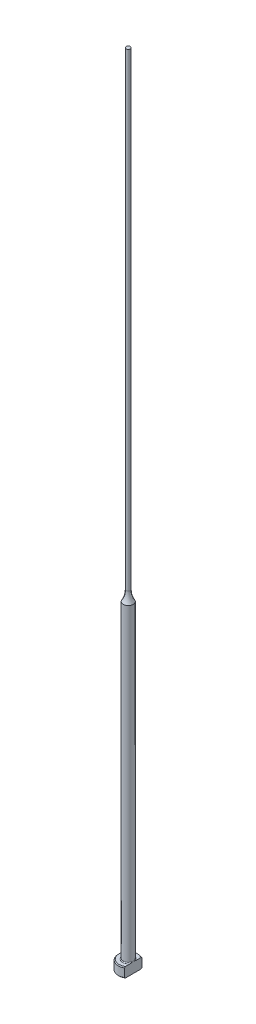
SolidWorks part; units mm, degrees
ref_plane "Front Plane" through (0, 0, 0) normal (0, 0, 1) x (1, 0, 0)
ref_plane "Top Plane" through (0, 0, 0) normal (0, 1, 0) x (1, 0, 0)
ref_plane "Right Plane" through (0, 0, 0) normal (1, 0, 0) x (0, 0, -1)
sketch "Sketch1" plane through (0, 0, 0) normal (0, 0, 1) x (1, 0, 0)
  line L0 (0, 259.9588) -> (0, -15.1925) construction
  line L1 (0, 0) -> (-3.175, 0)
  line L2 (-3.175, 0) -> (-3.175, 3.175)
  line L3 (-3.175, 3.175) -> (-1.5875, 3.175)
  line L4 (-0.6579, 104.9079) -> (-0.6579, 254)
  line L5 (-0.6579, 254) -> (0, 254)
  line L6 (0, 254) -> (0, 0)
  line L7 (-1.5875, 3.175) -> (-1.5875, 101.6)
  arc A0 (-1.5875, 101.6) -> (-0.6579, 104.9079) centre (-7.0079, 104.9079) ccw
  point P13 (-1.5875, 0)
  dimension "D1" = 6.35
  dimension "L" = 254
  dimension "D2" = 3.175
  dimension "H" = 6.35
  dimension "T" = 3.175
  dimension "D" = 1.3157
  dimension "S" = 101.6
revolve "Revolve1" add sketch "Sketch1" angle 360 about L0
chamfer "Chamfer1" distance 0.254 angle 45 2 edges at (0, 3.175, 3.175) (0, 0, 3.175)
fillet "Fillet1" radius 0.254 1 edges at (0, 3.175, 1.5875)
sketch "Sketch2" plane through (0, 0, 0) normal (0, 1, 0) x (1, 0, 0)
  line L0 (1.5875, -2.7496) -> (1.5875, 2.7496)
  circle A0 centre (0, 0) radius 3.175 construction
  arc A2 (1.5875, -2.7496) -> (1.5875, 2.7496) centre (0, 0) ccw
  circle A3 centre (0, 0) radius 3.175 construction
  circle A4 centre (0, 0) radius 1.5875 construction
extrude "Key Head" cut sketch "Sketch2" along normal up to next
